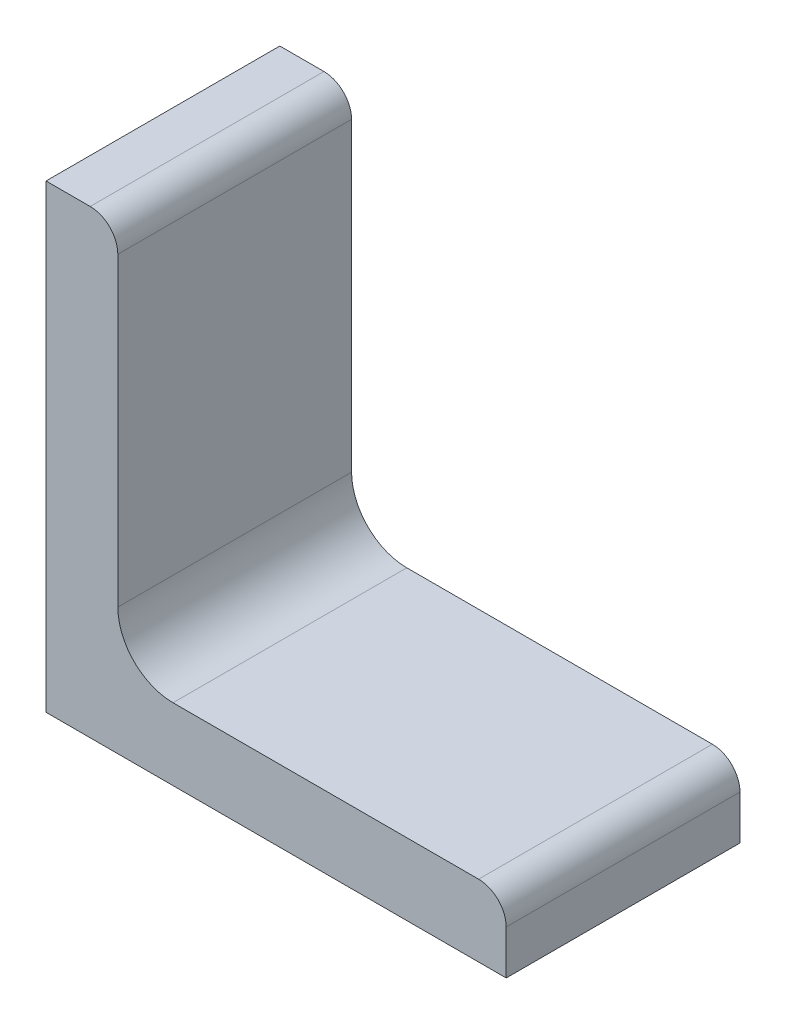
SolidWorks part; units mm, degrees
ref_plane "Front Plane" through (0, 0, 0) normal (0, 0, 1) x (1, 0, 0)
ref_plane "Top Plane" through (0, 0, 0) normal (0, 1, 0) x (1, 0, 0)
ref_plane "Right Plane" through (0, 0, 0) normal (1, 0, 0) x (0, 0, -1)
other "Configuration Table"
sketch "Sketch1" plane through (0, 0, 0) normal (0, 0, 1) x (1, 0, 0)
  line L1 (0, 0) -> (50, 0)
  line L2 (0, 0) -> (0, 50)
  line L3 (0, 50) -> (4.8, 50)
  line L4 (50, 0) -> (50, 4.8)
  line L6 (7.8, 47) -> (7.8, 13.8)
  line L7 (13.8, 7.8) -> (47, 7.8)
  arc A0 (7.8, 13.8) -> (13.8, 7.8) centre (13.8, 13.8) ccw
  arc A1 (4.8, 50) -> (7.8, 47) centre (4.8, 47) cw
  arc A2 (50, 4.8) -> (47, 7.8) centre (47, 4.8) ccw
  dimension "Radius_root" = 6
  dimension "Radius_toe" = 3
  dimension "Width" = 50
  dimension "Thickness" = 7.8
extrude "BaseSection" add sketch "Sketch1" along normal mid plane 25.4
